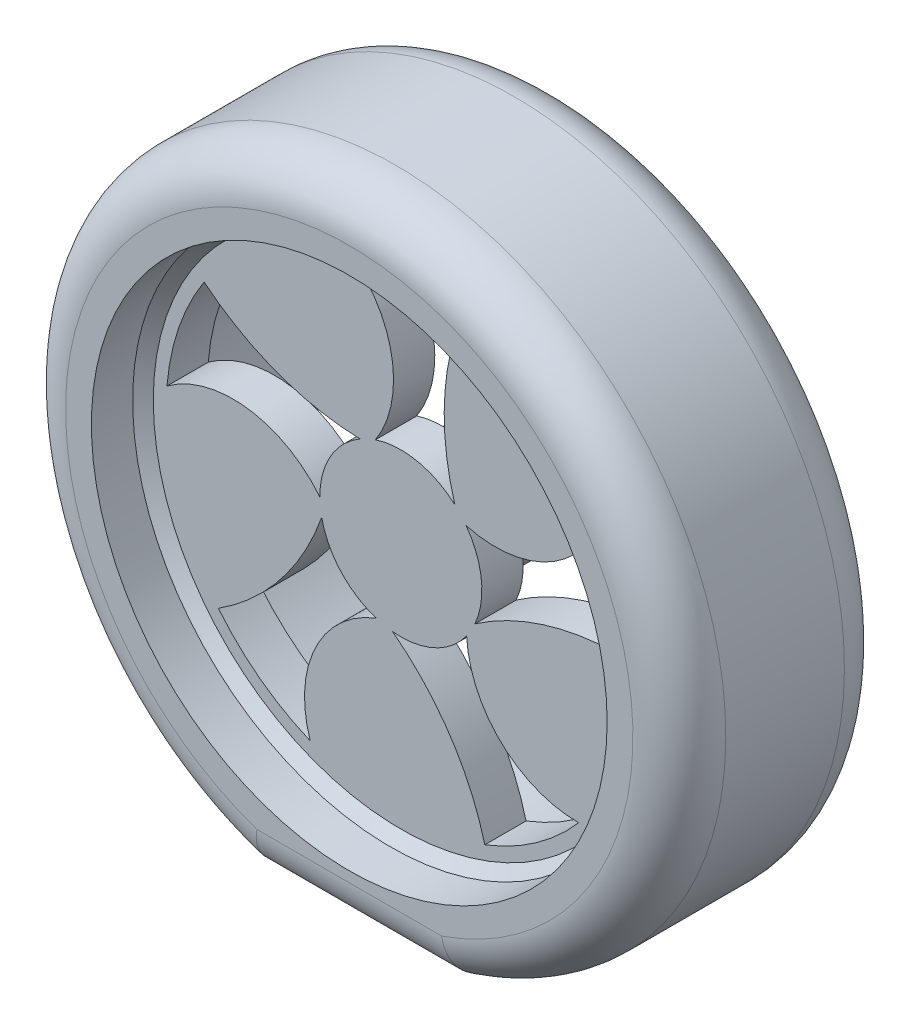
SolidWorks part; units mm, degrees
ref_plane "Ebene1" through (0, 0, 0) normal (0, 0, 1) x (1, 0, 0)
ref_plane "Ebene2" through (0, 0, 0) normal (0, 1, 0) x (1, 0, 0)
ref_plane "Ebene3" through (0, 0, 0) normal (1, 0, 0) x (0, 0, -1)
sketch "Skizze1" plane through (0, 0, 0) normal (0, 0, 1) x (1, 0, 0)
  line L3 (-96.8246, -305) -> (96.8246, -305)
  arc A0 (96.8246, -305) -> (-96.8246, -305) centre (0, 0) ccw
  dimension "D1" = 640
  dimension "D2" = 625
extrude "Basis-Linear austragen" add sketch "Skizze1" along normal blind 205
fillet "Verrundung1" radius 45
sketch "Skizze2" plane through (0, 0, 205) normal (0, 0, 1) x (1, 0, 0)
  circle A0 centre (0, 0) radius 250
  dimension "D1" = 500
extrude "Schnitt-Linear austragen1" cut sketch "Skizze2" against normal blind 50
sketch "Skizze3" plane through (0, 0, 0) normal (0, 0, -1) x (-1, 0, 0)
  circle A0 centre (0, 0) radius 250
  dimension "D1" = 500
extrude "Schnitt-Linear austragen2" cut sketch "Skizze3" against normal blind 115
sketch "Skizze4" plane through (0, 0, 115) normal (0, 0, -1) x (-1, 0, 0)
  circle A0 centre (0, 0) radius 55
  dimension "D1" = 110
extrude "Aufsatz-Linear austragen1" add sketch "Skizze4" along normal up to vertex
sketch "Skizze5" plane through (0, 0, 0) normal (0, 0, -1) x (-1, 0, 0)
  circle A0 centre (0, 0) radius 50
  dimension "D1" = 100
extrude "Schnitt-Linear austragen3" cut sketch "Skizze5" against normal blind 50
sketch "Skizze6" plane through (0, 0, 155) normal (0, 0, 1) x (1, 0, 0)
  arc A0 (-52.2991, 221.4019) -> (-24.6271, 74.5889) centre (-114.9554, 133.5778) cw
  arc A1 (59.0174, 219.7065) -> (52.3317, 58.5781) centre (290.2378, 129.4095) ccw
  arc A2 (59.0174, 219.7065) -> (-52.2991, 221.4019) centre (0, 0) ccw
  arc A3 (52.3317, 58.5781) -> (-24.6271, 74.5889) centre (0, 0) ccw
  arc A4 (194.4044, 118.1563) -> (63.3281, 46.471) centre (91.5168, 150.6069) cw
  arc A5 (71.8824, -31.6688) -> (63.3281, 46.471) centre (0, 0) ccw
  arc A6 (227.1907, 11.7641) -> (71.8824, -31.6688) centre (212.7642, -236.0428) ccw
  arc A7 (227.1907, 11.7641) -> (194.4044, 118.1563) centre (0, 0) ccw
  arc A8 (172.4476, -148.3773) -> (63.766, -45.8683) centre (171.516, -40.4976) cw
  arc A9 (-7.9059, -78.1505) -> (63.766, -45.8683) centre (0, 0) ccw
  arc A10 (81.3941, -212.4359) -> (-7.9059, -78.1505) centre (-158.7423, -275.292) ccw
  arc A11 (81.3941, -212.4359) -> (172.4476, -148.3773) centre (0, 0) ccw
  arc A12 (-87.826, -209.8585) -> (-23.9185, -74.8191) centre (14.4858, -175.6358) cw
  arc A13 (-76.7686, -16.6308) -> (-23.9185, -74.8191) centre (0, 0) ccw
  arc A14 (-176.8863, -143.0567) -> (-76.7686, -16.6308) centre (-310.8723, 65.903) ccw
  arc A15 (-176.8863, -143.0567) -> (-87.826, -209.8585) centre (0, 0) ccw
  arc A16 (-226.727, 18.6776) -> (-78.5485, -0.3725) centre (-162.5632, -68.0513) cw
  arc A17 (-39.5397, 67.8721) -> (-78.5485, -0.3725) centre (0, 0) ccw
  arc A18 (-190.7159, 124.022) -> (-39.5397, 67.8721) centre (-33.3874, 316.0223) ccw
  arc A19 (-190.7159, 124.022) -> (-226.727, 18.6776) centre (0, 0) ccw
extrude "Schnitt-Linear austragen4" cut sketch "Skizze6" against normal through all
chamfer "Fase1" distance 10 angle 45
